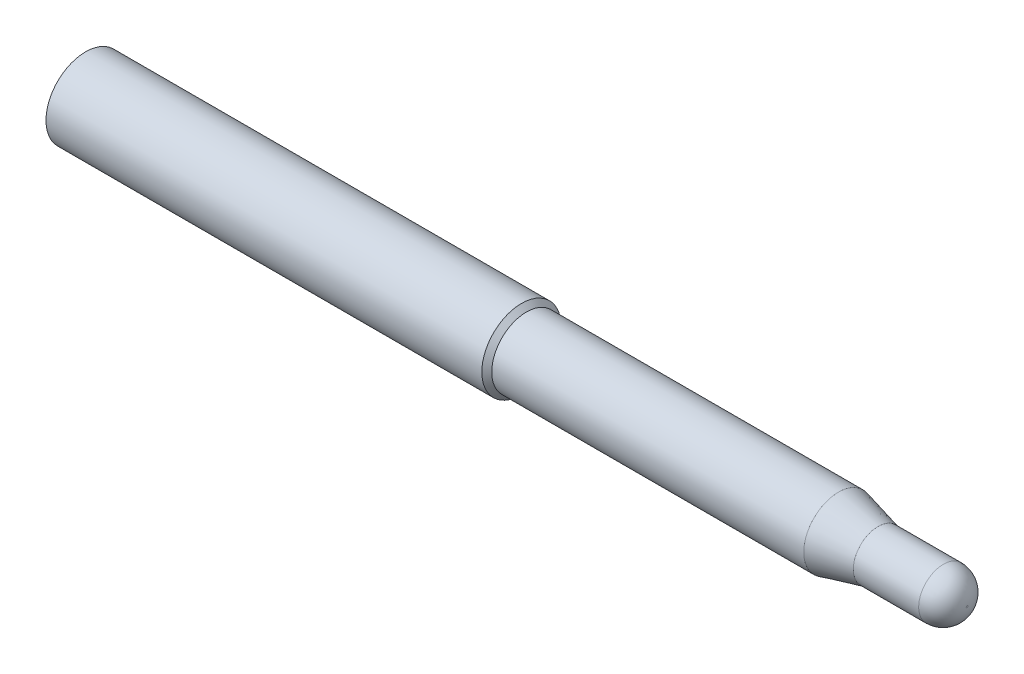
SolidWorks part; units mm, degrees
ref_plane "Přední rovina" through (0, 0, 0) normal (0, 0, 1) x (1, 0, 0)
ref_plane "Horní rovina" through (0, 0, 0) normal (0, 1, 0) x (1, 0, 0)
ref_plane "Pravá rovina" through (0, 0, 0) normal (1, 0, 0) x (0, 0, -1)
sketch "Skica1" plane through (0, 0, 0) normal (0, 0, 1) x (1, 0, 0)
  line L0 (0, 0) -> (0, 2)
  line L1 (0, 2) -> (22, 2)
  line L3 (22.25, 1.75) -> (38, 1.75)
  line L4 (22, 2) -> (22.25, 1.75)
  line L5 (40, 1.25) -> (44.5, 1.25)
  line L6 (44.5, 1.25) -> (44.5, 0)
  line L7 (44.5, 0) -> (0, 0)
  line L8 (38, 1.75) -> (40, 1.25)
  dimension "D1" = 44.5
  dimension "D2" = 22
  dimension "D3" = 38
  dimension "D4" = 2
  dimension "D5" = 1.75
  dimension "D6" = 1.25
  dimension "D7" = 2
  dimension "D8" = 45
revolve "Rotovat1" add sketch "Skica1" angle 360 about L7
fillet "Zaoblit1" radius 1.2 1 edges at (44.5, 1.25, 0)
